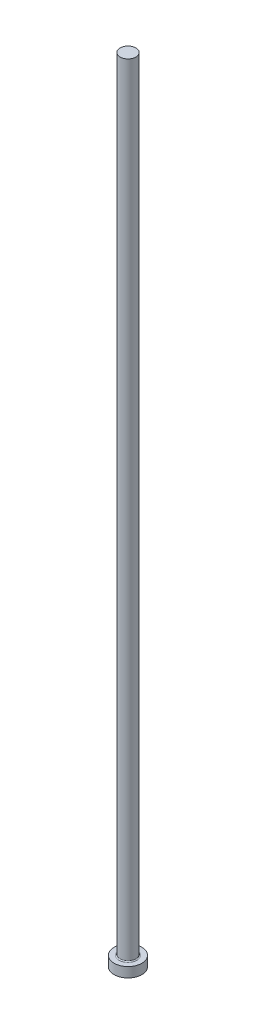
SolidWorks part; units mm, degrees
ref_plane "Plano frontal" through (0, 0, 0) normal (0, 0, 1) x (1, 0, 0)
ref_plane "Plano superior" through (0, 0, 0) normal (0, 1, 0) x (1, 0, 0)
ref_plane "Plano direito" through (0, 0, 0) normal (1, 0, 0) x (0, 0, -1)
sketch "Esboço1" plane through (0, 0, 0) normal (0, 0, 1) x (1, 0, 0)
  line L0 (0, 0) -> (7, 0)
  line L1 (7, 0) -> (7, 5)
  line L2 (7, 5) -> (4.5, 5)
  line L3 (4, 5.5) -> (4, 400)
  line L4 (4, 400) -> (0, 400)
  line L5 (0, 400) -> (0, 0) construction
  line L6 (0, 0) -> (0, 400)
  arc A0 (4.5, 5) -> (4, 5.5) centre (4.5, 5.5) cw
  dimension "D3" = 0.5
  dimension "D1" = 14
  dimension "D2" = 8
  dimension "D4" = 5
  dimension "D5" = 400
revolve "Revolução1" add sketch "Esboço1" angle 360 about L5
sketch "Esboço2"
  dimension "D1" = 0.525
  dimension "D2" = 1.225
  dimension "D3" = 0.7875
  dimension "D4" = 3.7625
wrap "Envolver1" sketch "Esboço2" source sketch "Esboço2" thickness 0.1 parameters "D1"=0.1
